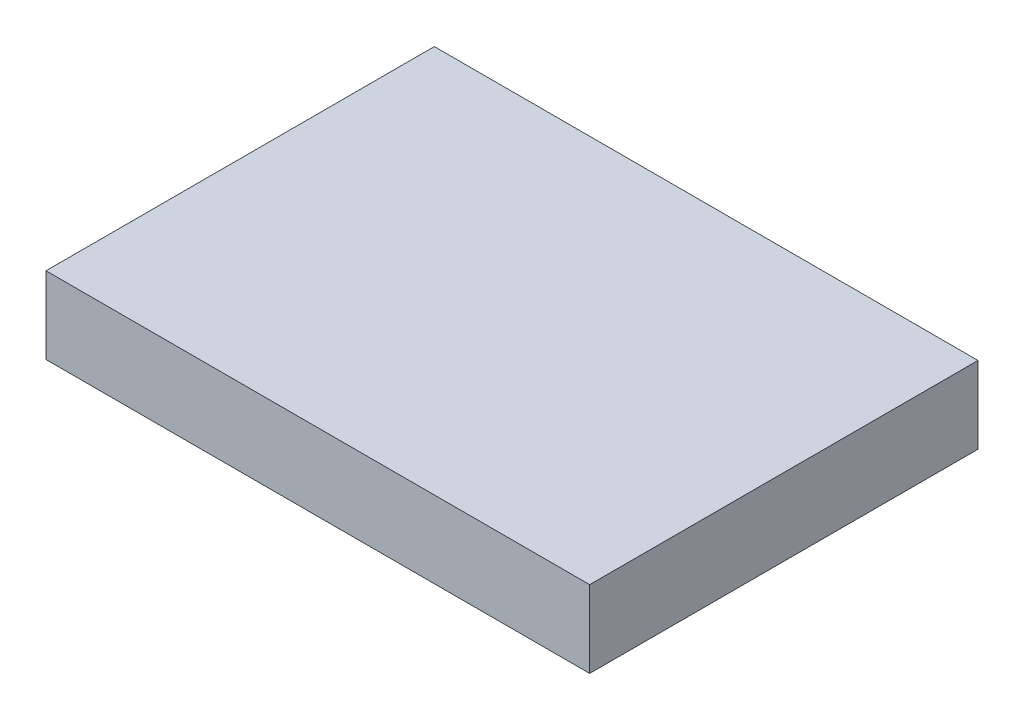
SolidWorks part; units mm, degrees
ref_plane "Frontal" through (0, 0, 0) normal (0, 0, 1) x (1, 0, 0)
ref_plane "Horizontal" through (0, 0, 0) normal (0, 1, 0) x (1, 0, 0)
ref_plane "Vertical" through (0, 0, 0) normal (1, 0, 0) x (0, 0, -1)
sketch "Esquisse1" plane through (0, 0, 0) normal (0, 0, 1) x (1, 0, 0)
  line L1 (0, 0) -> (70, 0)
  line L2 (0, 0) -> (0, 9.9)
  line L3 (0, 9.9) -> (70, 9.9)
  line L4 (70, 0) -> (70, 9.9)
  dimension "D1" = 9.9
  dimension "D2" = 70
extrude "Base-Extrusion" add sketch "Esquisse1" along normal mid plane 50
